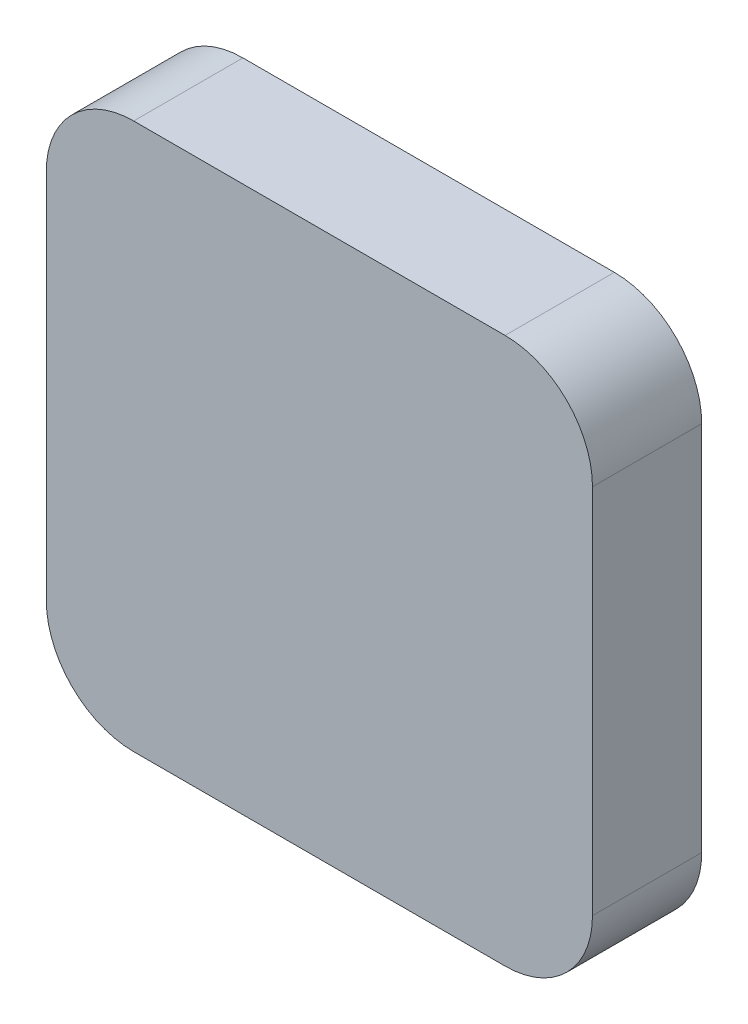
SolidWorks part; units mm, degrees
ref_plane "Face" through (0, 0, 0) normal (0, 0, 1) x (1, 0, 0)
ref_plane "Dessus" through (0, 0, 0) normal (0, 1, 0) x (1, 0, 0)
ref_plane "Droite" through (0, 0, 0) normal (1, 0, 0) x (0, 0, -1)
sketch "Esquisse1" plane through (0, 0, 0) normal (0, 0, 1) x (1, 0, 0)
  line L1 (-12.5, 12.5) -> (12.5, 12.5)
  line L2 (-12.5, 12.5) -> (-12.5, -12.5)
  line L3 (-12.5, -12.5) -> (12.5, -12.5)
  line L4 (12.5, 12.5) -> (12.5, -12.5)
  line L5 (-12.5, 12.5) -> (12.5, -12.5) construction
  line L6 (-12.5, -12.5) -> (12.5, 12.5) construction
  point P0 (0, 0)
  dimension "D1" = 25
extrude "Extrusion1" add sketch "Esquisse1" along normal blind 5
fillet "Congé1" radius 4 4 edges at (12.5, -12.5, 2.5) (-12.5, -12.5, 2.5) (-12.5, 12.5, 2.5) (12.5, 12.5, 2.5)
